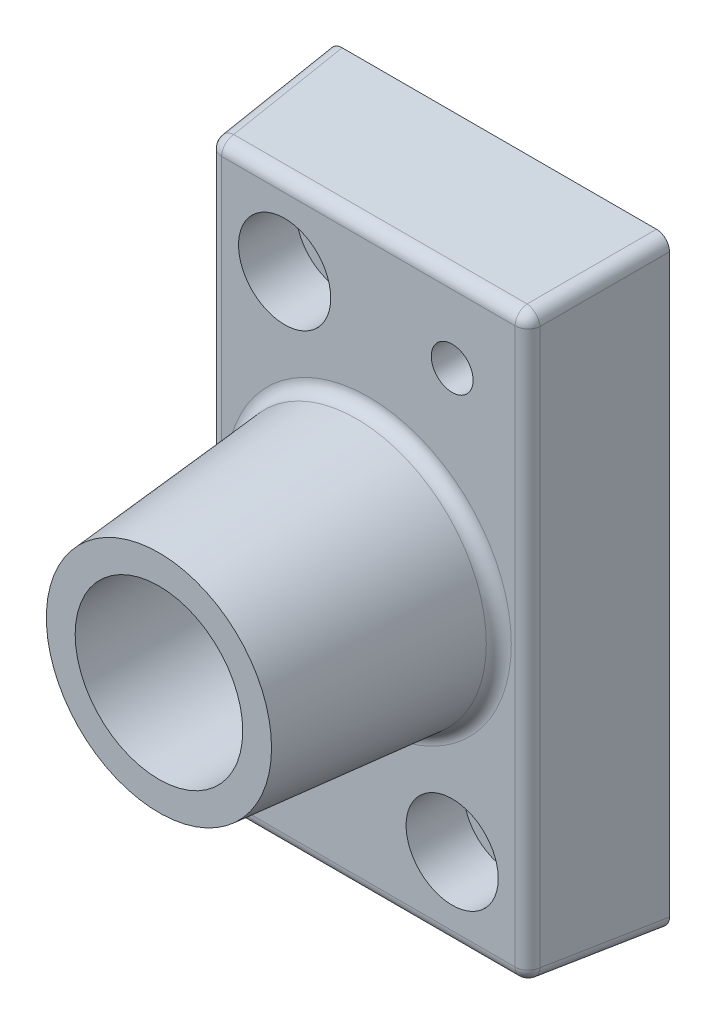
SolidWorks part; units mm, degrees
ref_plane "Frontal" through (0, 0, 0) normal (0, 0, 1) x (1, 0, 0)
ref_plane "Horizontal" through (0, 0, 0) normal (0, 1, 0) x (1, 0, 0)
ref_plane "Profil" through (0, 0, 0) normal (1, 0, 0) x (0, 0, -1)
sketch "Esquisse1" plane through (0, 0, 0) normal (0, 0, 1) x (1, 0, 0)
  line L1 (-32.5, 57.5) -> (32.5, 57.5)
  line L2 (-32.5, 57.5) -> (-32.5, -57.5)
  line L3 (-32.5, -57.5) -> (32.5, -57.5)
  line L4 (32.5, 57.5) -> (32.5, -57.5)
  point P7 (-32.5, -57.5)
  point P13 (32.5, 57.5)
  point P16 (-32.5, 57.5)
  dimension "D1" = 65
  dimension "D2" = 32.5
  dimension "D3" = 115
  dimension "D4" = 57.5
extrude "Base-Extrusion" add sketch "Esquisse1" along normal blind 25 draft 5
sketch "Esquisse2" plane through (0, 0, 25) normal (0, 0, 1) x (1, 0, 0)
  circle A0 centre (0, 0) radius 25
  dimension "D1" = 50
extrude "Boss.-Extru.1" add sketch "Esquisse2" along normal blind 40 draft 5
fillet "Congé1" radius 2.5
sketch "Esquisse3" plane through (0, 0, 0) normal (0, 0, -1) x (-1, 0, 0)
  circle A0 centre (0, 0) radius 18
  dimension "D1" = 36
extrude "Enlèv. mat.-Extru.1" cut sketch "Esquisse3" against normal blind 8.03
sketch "Esquisse4" plane through (0, 0, 65) normal (0, 0, 1) x (1, 0, 0)
  circle A0 centre (0, 0) radius 16
  dimension "D1" = 32
extrude "Enlèv. mat.-Extru.2" cut sketch "Esquisse4" against normal through all
hole_wizard "Perçage1" positions "Esquisse6" profile "Esquisse5" counterbore size "M10" standard "Ansi Métrique"
sketch "Esquisse6" plane through (0, 0, 25) normal (0, 0, 1) x (1, 0, 0)
  point P0 (16, -40)
  point P1 (-16, 40)
  dimension "D1" = 40
  dimension "D2" = 40
  dimension "D3" = 16
  dimension "D4" = 16
sketch "Esquisse5" plane through (16, -40, 25) normal (1, 0, 0) x (0, -1, 0)
  line L0 (0, 0) -> (0, 25)
  line L1 (0, 25) -> (5.5, 25)
  line L3 (5.5, 25) -> (5.5, 11)
  line L4 (5.5, 11) -> (8.8, 11)
  line L5 (8.8, 11) -> (8.8, 0)
  line L7 (8.8, 0) -> (0, 0)
  line L11 (0, -6.35) -> (0, 107.95) construction
  dimension "Diamètre du perçage jusqu'au prochain" = 11
  dimension "Profondeur du perçage jusqu'au prochain" = 25
  dimension "Diamètre du chambrage" = 17.6
  dimension "Profondeur du chambrage" = 11
sketch "Esquisse7" plane through (0, 0, 25) normal (0, 0, 1) x (1, 0, 0)
  circle A0 centre (16, 40) radius 4
  circle A1 centre (-16, -40) radius 4
  dimension "D1" = 8
  dimension "D2" = 16
  dimension "D3" = 40
  dimension "D4" = 80
  dimension "D5" = 32
extrude "Enlèv. mat.-Extru.3" cut sketch "Esquisse7" against normal through all
